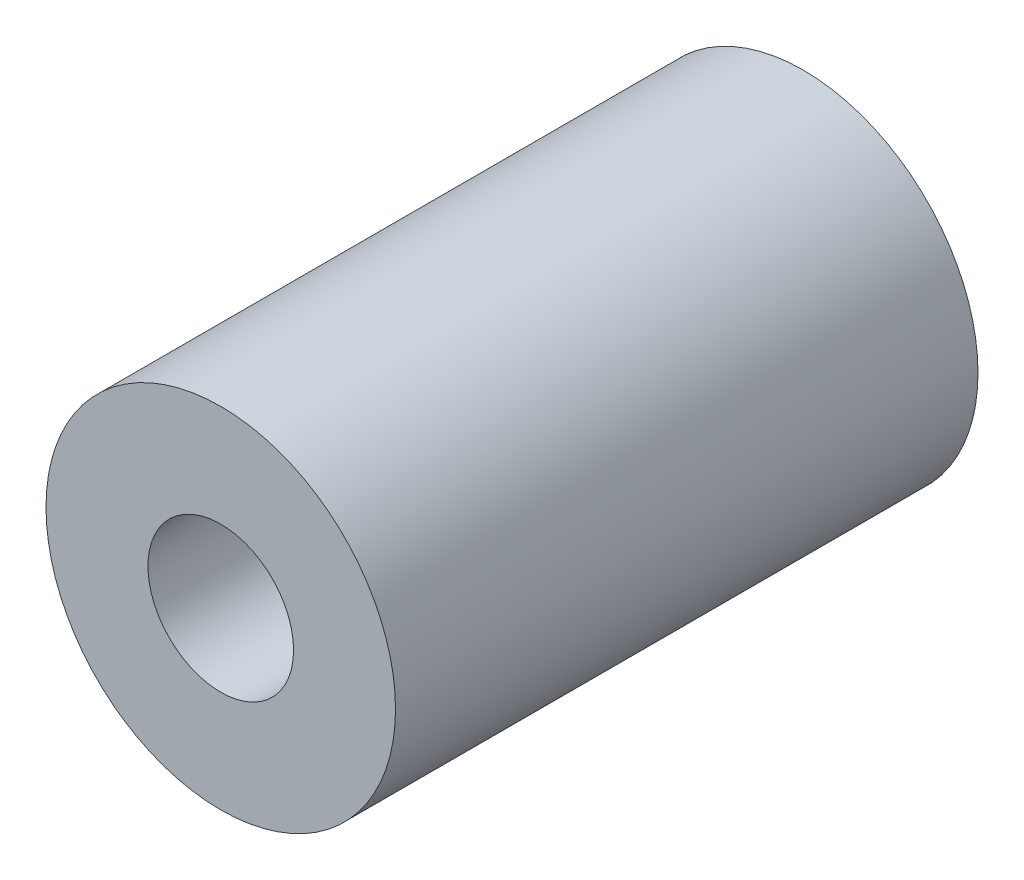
SolidWorks part; units mm, degrees
ref_plane "Plan de face" through (0, 0, 0) normal (0, 0, 1) x (1, 0, 0)
ref_plane "Plan de dessus" through (0, 0, 0) normal (0, 1, 0) x (1, 0, 0)
ref_plane "Plan de droite" through (0, 0, 0) normal (1, 0, 0) x (0, 0, -1)
sketch "Esquisse1" plane through (0, 0, 0) normal (0, 0, 1) x (1, 0, 0)
  circle A0 centre (0, 0) radius 1.2
  circle A1 centre (0, 0) radius 0.5
  dimension "D1" = 1
  dimension "D2" = 2.4
extrude "Boss.-Extru.1" add sketch "Esquisse1" along normal mid plane 4
